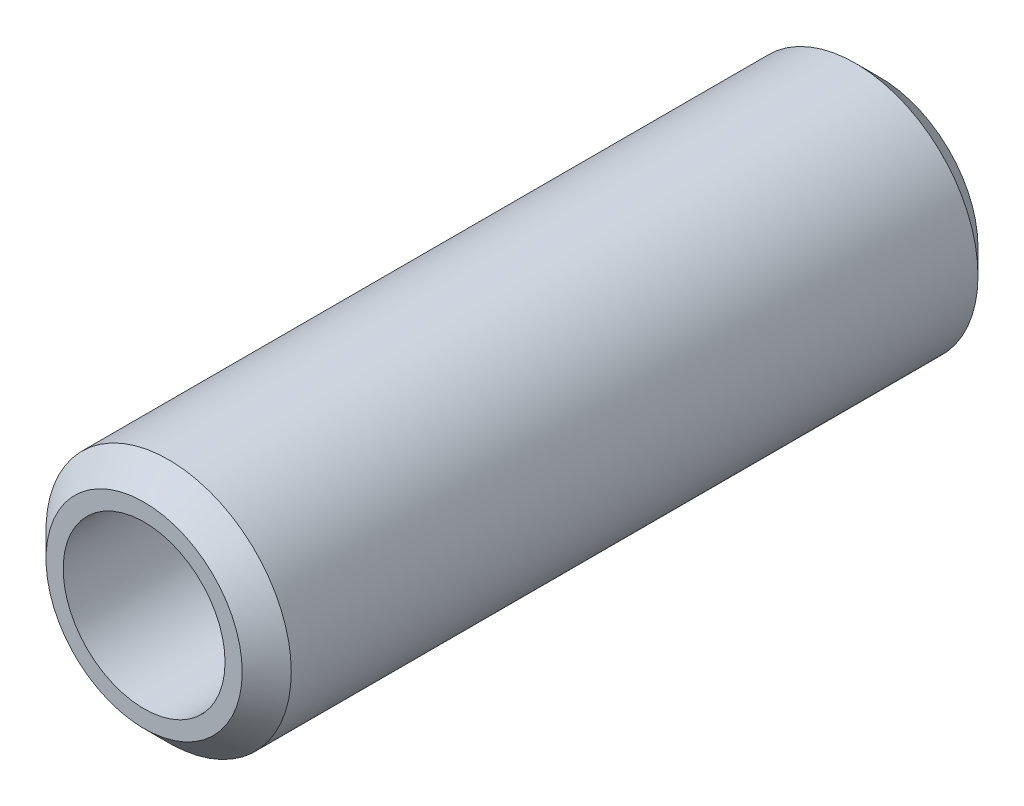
SolidWorks part; units mm, degrees
ref_plane "Plan de face" through (0, 0, 0) normal (0, 0, 1) x (1, 0, 0)
ref_plane "Plan de dessus" through (0, 0, 0) normal (0, 1, 0) x (1, 0, 0)
ref_plane "Plan de droite" through (0, 0, 0) normal (1, 0, 0) x (0, 0, -1)
sketch "Esquisse1" plane through (0, 0, 0) normal (0, 0, 1) x (1, 0, 0)
  circle A0 centre (0, 0) radius 2.5
  dimension "D1" = 5
extrude "Extrusion1" add sketch "Esquisse1" along normal blind 15
chamfer "Chanfrein1" distance 0.5 angle 45 2 edges at (2.5, 0, 0) (2.5, 0, 15)
hole_wizard "Trou taraudé M41" positions "Esquisse3" profile "Esquisse2" tap size "M4" standard "ISO"
sketch "Esquisse3" plane through (0, 0, 15) normal (0, 0, 1) x (1, 0, 0)
  point P0 (0, 0)
sketch "Esquisse2" plane through (0, 0, 15) normal (1, 0, 0) x (0, -1, 0)
  line L0 (0, 0) -> (0, 15)
  line L1 (0, 15) -> (1.65, 15)
  line L2 (1.65, 15) -> (1.65, 0)
  line L5 (1.65, 0) -> (0, 0)
  line L11 (0, -6.35) -> (0, 107.95) construction
  dimension "Diamètre du trou pour taraudage jusqu'au prochain" = 3.3
  dimension "Profondeur du trou pour taraudage jusqu'au prochain" = 15
